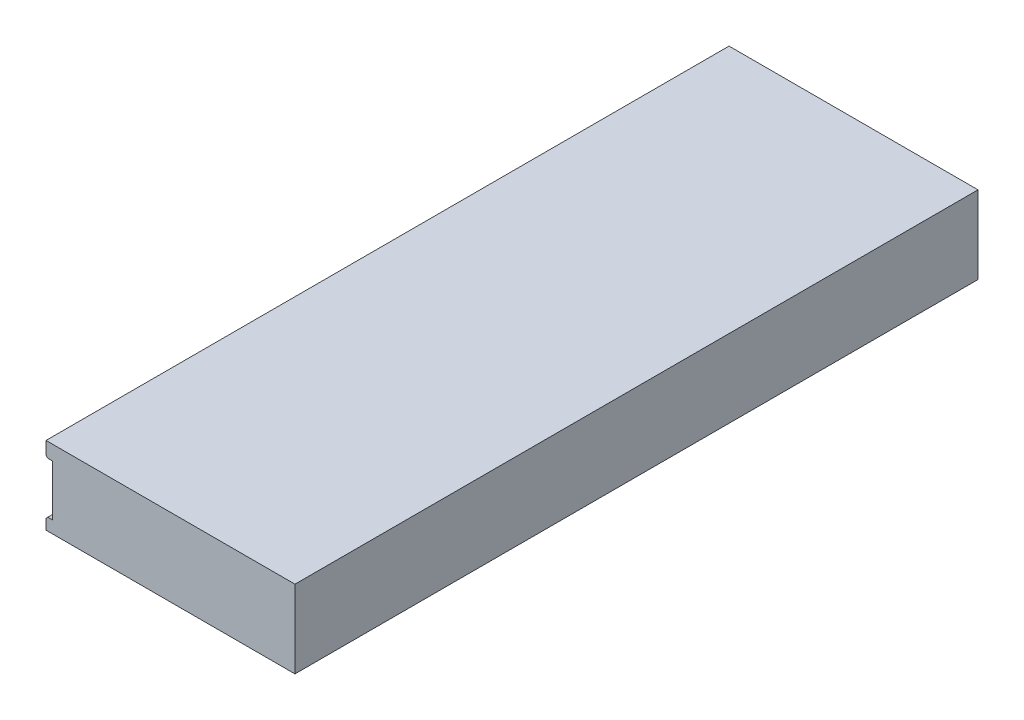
SolidWorks part; units mm, degrees
ref_plane "FRONT" through (0, 0, 0) normal (0, 0, 1) x (1, 0, 0)
ref_plane "TOP" through (0, 0, 0) normal (0, 1, 0) x (1, 0, 0)
ref_plane "RIGHT" through (0, 0, 0) normal (1, 0, 0) x (0, 0, -1)
sketch "Sketch1" plane through (0, 0, 0) normal (0, 0, 1) x (1, 0, 0)
  line L0 (50.673, 0) -> (50.673, -16.256)
  line L1 (50.673, -16.256) -> (-1.397, -16.256)
  line L2 (-1.397, -16.256) -> (-1.397, -13.716)
  line L3 (-1.397, -13.716) -> (0, -13.716)
  line L4 (0, -13.716) -> (0, -3.048)
  line L5 (0, -3.048) -> (-1.397, -3.048)
  line L6 (-1.397, -3.048) -> (-1.397, 0)
  line L7 (-1.397, 0) -> (50.673, 0)
  dimension "D1" = 52.07
  dimension "D2" = 50.673
  dimension "D3" = 3.048
  dimension "D4" = 2.54
  dimension "D5" = 16.256
extrude "Extrude1" add sketch "Sketch1" along normal mid plane 142.8496
sketch "Sketch2" plane through (0, 0, 0) normal (-1, 0, 0) x (0, 0, 1)
  line L1 (0, 0) -> (0, -16.256) construction
  line L2 (71.4248, -16.256) -> (-71.4248, -16.256) construction
  line L3 (0, -8.128) -> (26.0126, -8.128) construction
  point P0 (-66.548, -8.128)
  point P1 (66.548, -8.128)
  point P2 (4.8768, -8.128)
  point P4 (-4.8768, -8.128)
  dimension "D1" = 66.548
  dimension "D2" = 66.548
  dimension "D3" = 4.8768
hole_wizard "#10-32 Tapped Hole1" positions "3DSketch1" profile "Sketch3" tap size "#10-32" standard "Ansi Inch"
sketch3d "3DSketch1"
  point P0 (0, -8.128, -66.548)
  point P3 (0, -8.128, 66.548)
  point P6 (0, -8.128, 4.8768)
  point P9 (0, -8.128, -4.8768)
sketch "Sketch3" plane through (0, -8.128, -66.548) normal (0, 1, 0) x (0, 0, 1)
  line L0 (0, 0) -> (0, 11.2108)
  line L1 (0, 11.2108) -> (2.0193, 9.9974)
  line L2 (2.0193, 9.9974) -> (2.0193, 7.62)
  line L3 (2.0193, 7.62) -> (2.413, 7.62)
  line L4 (2.413, 7.62) -> (2.413, 0)
  line L5 (2.413, 0) -> (0, 0)
  line L10 (0, 11.2108) -> (-2.0193, 9.9974) construction
  line L11 (0, -6.35) -> (0, 107.95) construction
  dimension "Tap Drill Dia." = 4.0386
  dimension "Tap Drill Depth" = 9.9974
  dimension "Thread Major Dia." = 4.826
  dimension "Thread Depth" = 7.62
  dimension "Drill Angle" = 118
chamfer "Chamfer1" distance 0.381 angle 45 2 edges at (-1.397, -13.716, 0) (-1.397, -3.048, 0)
